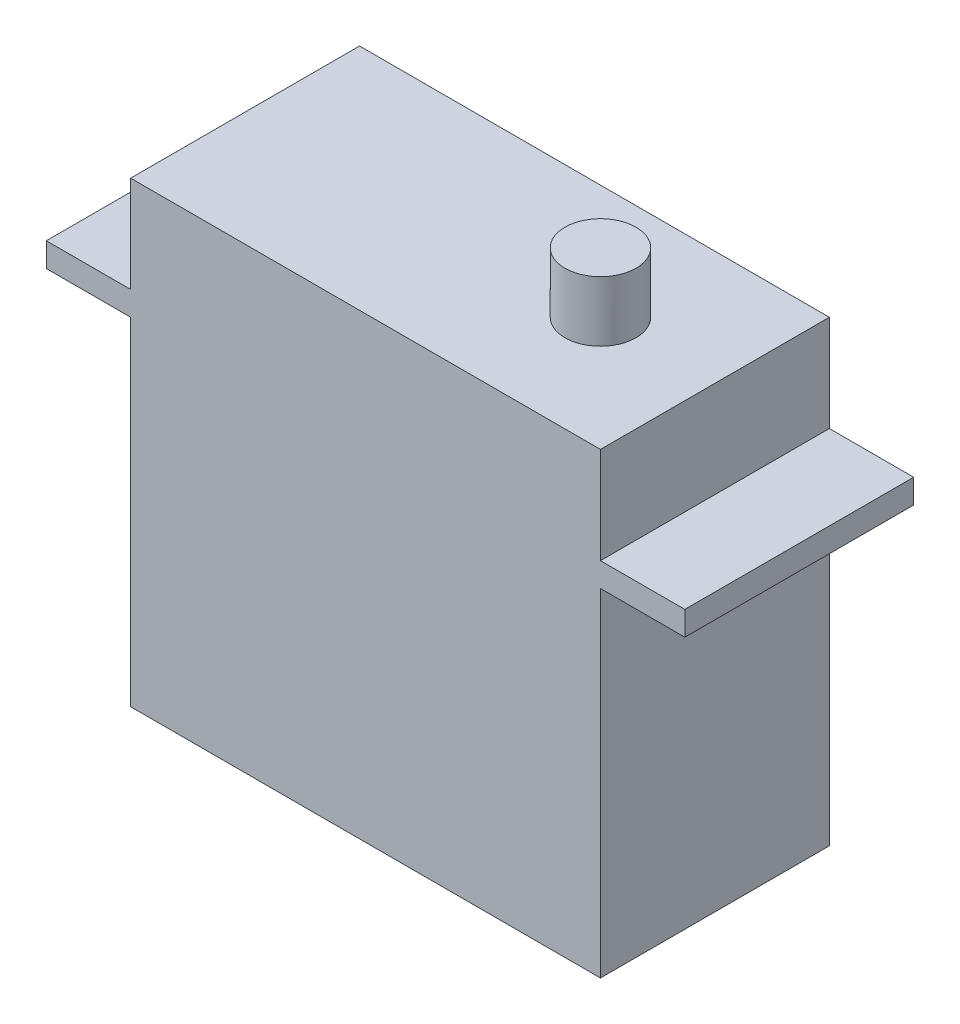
SolidWorks part; units mm, degrees
ref_plane "Plan de face" through (0, 0, 0) normal (0, 0, 1) x (1, 0, 0)
ref_plane "Plan de dessus" through (0, 0, 0) normal (0, 1, 0) x (1, 0, 0)
ref_plane "Plan de droite" through (0, 0, 0) normal (1, 0, 0) x (0, 0, -1)
sketch "Esquisse1" plane through (0, 0, 0) normal (0, 0, 1) x (1, 0, 0)
  line L0 (0, 0) -> (0, 28)
  line L1 (0, 0) -> (39, 0)
  line L2 (0, 28) -> (39, 28)
  line L3 (39, 0) -> (39, 28)
  line L4 (39, 28) -> (0, 28)
  line L5 (39, 28) -> (39, 38)
  line L6 (0, 28) -> (0, 38)
  line L7 (39, 38) -> (0, 38)
  line L8 (39, 28) -> (46, 28)
  line L9 (39, 28) -> (39, 30)
  line L10 (46, 28) -> (46, 30)
  line L11 (39, 30) -> (46, 30)
  line L12 (0, 28) -> (-7, 28)
  line L13 (0, 28) -> (0, 30)
  line L14 (-7, 28) -> (-7, 30)
  line L15 (0, 30) -> (-7, 30)
  point P14 (-0.3418, 28)
  dimension "D1" = 39
  dimension "D2" = 28
  dimension "D3" = 2
  dimension "D4" = 38
  dimension "D5" = 2
  dimension "D6" = 53
extrude "Boss.-Extru.1" add sketch "Esquisse1" along normal blind 19 contours L1 L3 L2 L0 | L5 L7 L6 L2 | L6 L15 L14 L12 | L11 L5 L8 L10
sketch "Esquisse2" plane through (0, 38, 0) normal (0, 1, 0) x (1, 0, 0)
  line L0 (39, -19) -> (0, -19) construction
  line L2 (39, 0) -> (0, 0) construction
  line L3 (39, -19) -> (39, 0) construction
  circle A0 centre (29.5, -9.5) radius 9.5
  circle A1 centre (29.5, -9.5) radius 2.95
  dimension "D1" = 5.9
extrude "Boss.-Extru.2" add sketch "Esquisse2" along normal blind 5 contours A1
